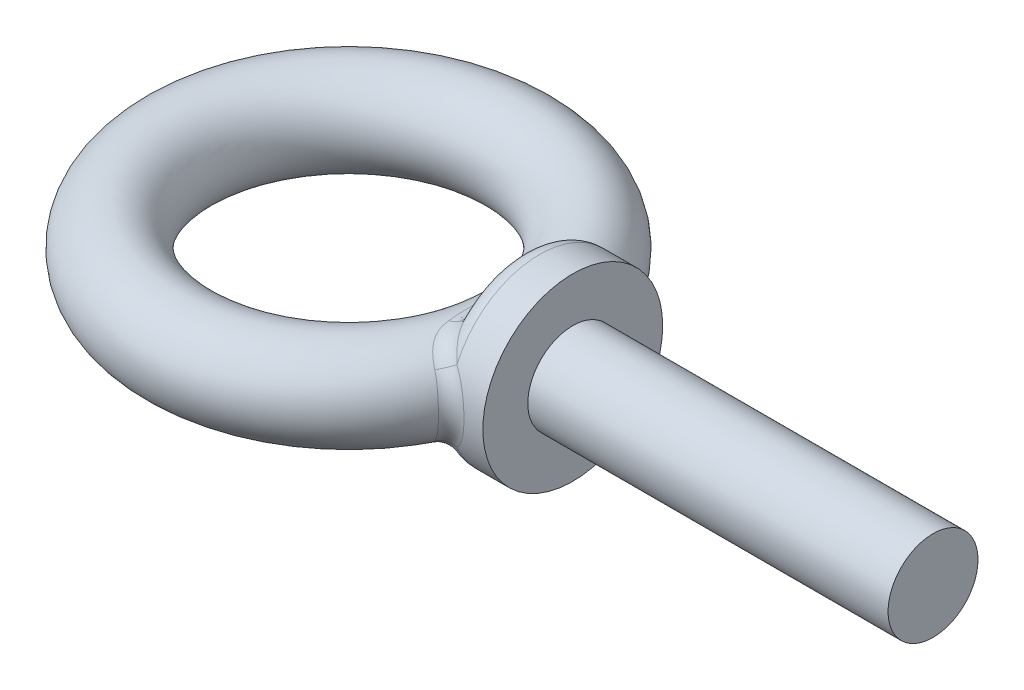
SolidWorks part; units mm, degrees
ref_plane "Front Plane" through (0, 0, 0) normal (0, 0, 1) x (1, 0, 0)
ref_plane "Top Plane" through (0, 0, 0) normal (0, 1, 0) x (1, 0, 0)
ref_plane "Right Plane" through (0, 0, 0) normal (1, 0, 0) x (0, 0, -1)
sketch "layout" plane through (0, 0, 0) normal (0, 1, 0) x (1, 0, 0)
  line L0 (0, 0) -> (41.275, 0) construction
  line L1 (-8.763, 0) -> (-15.113, 0) construction
  circle A0 centre (0, 0) radius 15.113 construction
  circle A1 centre (0, 0) radius 8.763 construction
  dimension "D1" = 30.226
  dimension "F" = 56.388
  dimension "DIA" = 6.35
sketch "Sketch2" plane through (0, 0, 0) normal (0, 0, 1) x (1, 0, 0)
  line L3 (0, 0) -> (0, 6.6909) construction
  line L4 (15.113, 0) -> (-15.113, 0) construction
  circle A0 centre (-11.938, 0) radius 3.175
  point P4 (-15.113, 0)
  dimension "D1" = 6.35
revolve "Revolve1" add sketch "Sketch2" angle 360 about L3
sketch "Sketch3" plane through (0, 0, 0) normal (0, 1, 0) x (1, 0, 0)
  line L0 (13.7142, 0) -> (13.7142, 6.35) construction
  line L1 (15.8372, 6.35) -> (15.8372, 3.175)
  line L2 (15.8372, 3.175) -> (41.275, 3.175)
  line L3 (41.275, 3.175) -> (41.275, 0)
  line L4 (0, 0) -> (59.9404, 0) construction
  line L5 (13.7142, 6.35) -> (15.8372, 6.35)
  line L6 (13.7142, 0) -> (8.763, 0) construction
  line L7 (0, 0) -> (41.275, 0) construction
  line L8 (11.2386, 0) -> (11.2386, -2.9252) construction
  line L9 (41.275, 0) -> (11.2386, 0)
  line L10 (14.7757, 3.175) -> (13.7142, 3.175) construction
  line L11 (12.9715, 17.6146) -> (15.0945, 17.6146) construction
  line L12 (15.0945, 17.6146) -> (12.9715, 18.6761) construction
  line L13 (12.6527, 6.35) -> (13.7142, 6.35)
  line L14 (12.9715, 18.1453) -> (14.033, 18.1453) construction
  line L15 (12.9715, 18.6761) -> (12.9715, 17.6146) construction
  line L16 (14.7757, 3.175) -> (15.8372, 3.175) construction
  circle A1 centre (0, 0) radius 15.113 construction
  arc A2 (12.6527, 6.35) -> (11.2386, 0) centre (26.2027, 0) ccw
  circle A4 centre (0, 0) radius 8.763 construction
  dimension "D2" = 6.35
  dimension "K" = 12.7
revolve "Revolve2" add sketch "Sketch3" angle 360 about L9
fillet "Fillet1" radius 1.27 6 edges at (13.6966, -0.3584, -6.3399) (11.5928, -3.1584, -0.7057) (11.5928, 3.1584, 0.7057) (13.6966, 0.3584, 6.3399) (12.6527, -6.35, 0) (12.6527, 6.35, 0)
sketch "Sketch4" plane through (0, 0, 0) normal (0, 1, 0) x (1, 0, 0)
  line L0 (41.275, 2.3813) -> (41.7333, 3.175)
  line L1 (41.7333, 3.175) -> (41.7333, 4.0915)
  line L2 (41.7333, 4.0915) -> (40.8167, 4.0915)
  line L3 (40.8167, 4.0915) -> (40.8167, 3.175)
  line L4 (40.8167, 3.175) -> (41.275, 2.3813)
  line L5 (0, 0) -> (44.568, 0) construction
  line L6 (41.275, -3.175) -> (41.275, 3.175) construction
  dimension "D1" = 4.7625
  dimension "D2" = 6.35
revolve "Cut-Revolve1" [suppressed] cut sketch "Sketch4" angle 360 about L5
pattern_linear "LPattern1" [suppressed] count 15 along (1, 0, 0)
equation "\"D1@Sketch2\" = \"DIA@layout\""
equation "\"D2@Sketch3\" = \"DIA@layout\""
equation "\"D1@Fillet1\" = \"DIA@layout\" / 5"
equation "\"D1@Sketch4\" = \"D2@Cosmetic Thread1\""
equation "\"D2@Sketch4\" = \"DIA@layout\""
equation "\"D1@LPattern1\" = \"D1@Cosmetic Thread1\" / \"P@LPattern1\""
